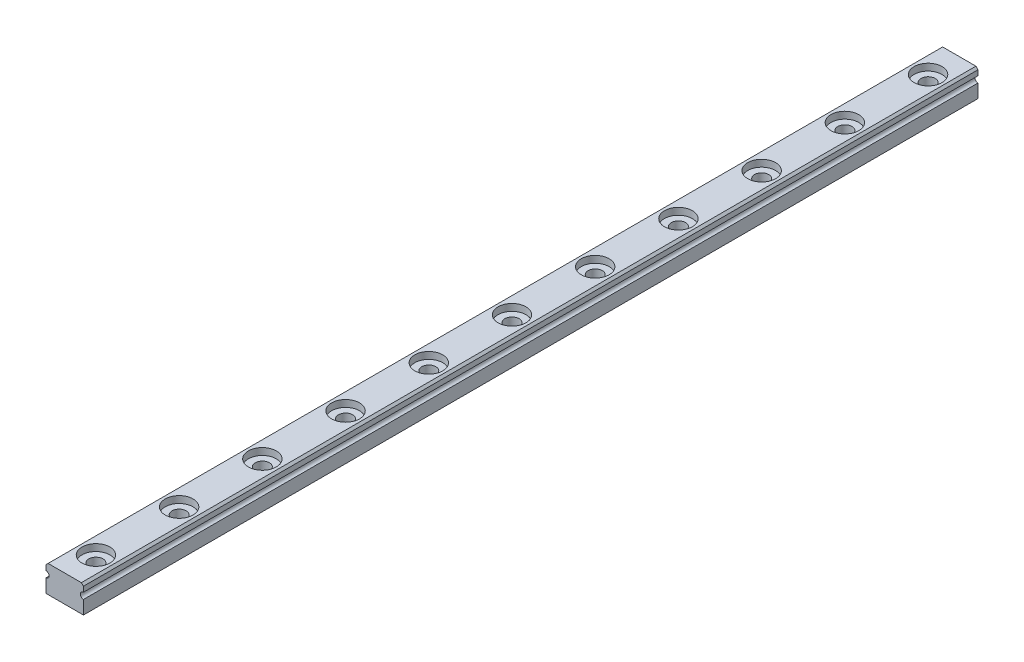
SolidWorks part; units mm, degrees
ref_plane "Front Plane" through (0, 0, 0) normal (0, 0, 1) x (1, 0, 0)
ref_plane "Top Plane" through (0, 0, 0) normal (0, 1, 0) x (1, 0, 0)
ref_plane "Right Plane" through (0, 0, 0) normal (1, 0, 0) x (0, 0, -1)
sketch "Sketch2" plane through (0, 0, 0) normal (0, 0, 1) x (1, 0, 0)
  line L0 (4.5, 0) -> (4.5, 6.5) construction
  line L1 (0, 0) -> (9, 0)
  line L2 (0, 0) -> (0, 3.25)
  line L3 (0, 6.5) -> (9, 6.5)
  line L4 (9, 0) -> (9, 3.25)
  line L5 (0, 3.25) -> (0, 4.75) construction
  line L6 (0, 4.75) -> (0, 6.5)
  line L7 (9, 3.25) -> (9, 4.75) construction
  line L8 (9, 4.75) -> (9, 6.5)
  arc A0 (0, 3.25) -> (0, 4.75) centre (0, 4) ccw
  arc A1 (9, 3.25) -> (9, 4.75) centre (9, 4) cw
  arc A2 (0, 4.75) -> (0, 3.25) centre (0, 4) ccw construction
  arc A3 (9, 4.75) -> (9, 3.25) centre (9, 4) cw construction
  dimension "D3" = 1.5
  dimension "D4" = 4
  dimension "D1" = 6.5
  dimension "D2" = 9
extrude "Boss-Extrude1" add sketch "Sketch2" along normal blind 215
ref_plane "Plane1" through (0, 0, 207.5) normal (0, 0, 1) x (1, 0, 0)
sketch "Sketch3" plane through (0, 0, 207.5) normal (0, 0, 1) x (1, 0, 0)
  line L0 (4.5, 6.5) -> (4.5, 0)
  line L2 (2.8, 5.8245) -> (6.2, 5.8245)
  line L3 (2.8, 5.8245) -> (2.8, 0)
  line L4 (2.8, 0) -> (6.2, 0)
  line L5 (6.2, 5.8245) -> (6.2, 0)
  line L6 (0, 3.25) -> (0, 0)
  line L7 (0, 0) -> (9, 0)
  line L8 (9, 0) -> (9, 3.25)
  line L9 (9, 4.75) -> (9, 6.5)
  line L10 (9, 6.5) -> (0, 6.5)
  line L11 (0, 6.5) -> (0, 4.75)
  line L12 (0, 3.25) -> (0, 0) construction
  line L13 (0, 0) -> (9, 0) construction
  line L14 (9, 0) -> (9, 3.25) construction
  line L15 (9, 4.75) -> (9, 6.5) construction
  line L16 (9, 6.5) -> (0, 6.5) construction
  line L17 (0, 6.5) -> (0, 4.75) construction
  line L18 (2.8, 5.8245) -> (6.2, 0) construction
  line L19 (2.8, 0) -> (6.2, 5.8245) construction
  line L20 (1.15, 4.85) -> (7.85, 4.85)
  line L21 (1.15, 4.85) -> (1.15, 6.5)
  line L22 (1.15, 6.5) -> (7.85, 6.5)
  line L23 (7.85, 4.85) -> (7.85, 6.5)
  line L24 (1.15, 4.85) -> (7.85, 6.5) construction
  line L25 (1.15, 6.5) -> (7.85, 4.85) construction
  arc A2 (9, 4.75) -> (9, 3.25) centre (9, 4) ccw
  arc A3 (0, 3.25) -> (0, 4.75) centre (0, 4) ccw
  arc A4 (9, 4.75) -> (9, 3.25) centre (9, 4) ccw construction
  arc A5 (0, 3.25) -> (0, 4.75) centre (0, 4) ccw construction
  point P9 (4.5, 2.9122)
  point P17 (4.5, 5.675)
  dimension "D2" = 3.4
  dimension "D3" = 6.7
  dimension "D4" = 5.8245
  dimension "D5" = 1.65
  dimension "D1" = 0
revolve "Cut-Revolve1" cut sketch "Sketch3" angle 360 about L0
pattern_linear "LPattern1" count 11 spacing 20 along (0, 0, -1) of "Cut-Revolve1"
chamfer "Chamfer1" distance 0.5 angle 45 2 edges at (0, 6.5, 107.5) (9, 6.5, 107.5)
